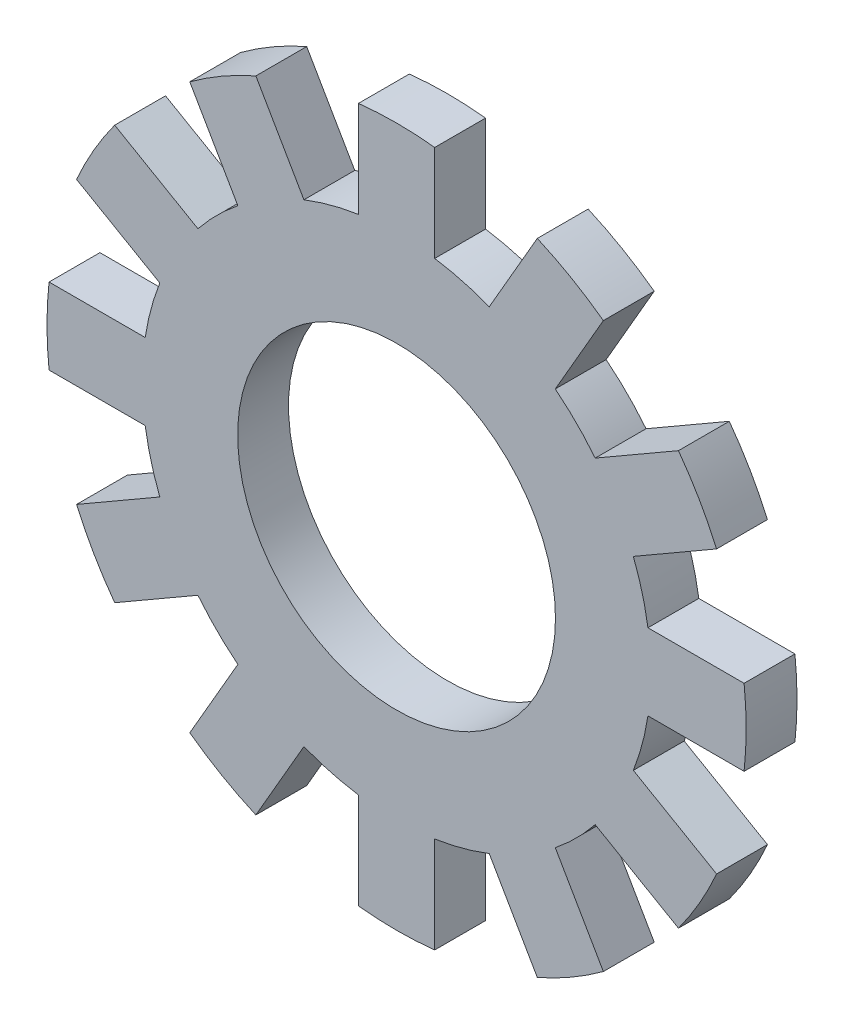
SolidWorks part; units mm, degrees
ref_plane "Front Plane" through (0, 0, 0) normal (0, 0, 1) x (1, 0, 0)
ref_plane "Top Plane" through (0, 0, 0) normal (0, 1, 0) x (1, 0, 0)
ref_plane "Right Plane" through (0, 0, 0) normal (1, 0, 0) x (0, 0, -1)
sketch "Sketch1" plane through (0, 0, 0) normal (0, 0, 1) x (1, 0, 0)
  circle A0 centre (0, 0) radius 1.25
  circle A1 centre (0, 0) radius 2
  dimension "D1" = 2.5
  dimension "D2" = 4
extrude "Boss-Extrude1" add sketch "Sketch1" along normal mid plane 0.4
sketch "Sketch2" plane through (0, 0, 0) normal (0, 0, 1) x (1, 0, 0)
  line L0 (0, 2.6811) -> (0, -2.8425) construction
sketch "Sketch3" plane through (0, 0, 0) normal (0, 0, 1) x (1, 0, 0)
  line L0 (-0.3, 2.7336) -> (-0.3, 1.9774)
  line L2 (0, 2.6811) -> (0, -2.8425) construction
  line L3 (0, 2) -> (0, 2.75)
  arc A0 (0, 2.75) -> (-0.3, 2.7336) centre (0, 0) ccw
  arc A1 (0, 2) -> (-0.3, 1.9774) centre (0, 0) ccw
  circle A2 centre (0, 0) radius 2 construction
  dimension "D2" = 2.75
  dimension "D1" = 0.3
extrude "Boss-Extrude2" add sketch "Sketch3" along normal mid plane 0.4
mirror "Mirror1" about plane through (0, 0, 0) normal (1, 0, 0) of "Boss-Extrude2"
pattern_circular "CirPattern2" count 12 over 360 about axis through (0, 0, 0) along (0, 0, 1) of "Boss-Extrude2", "Mirror1"
